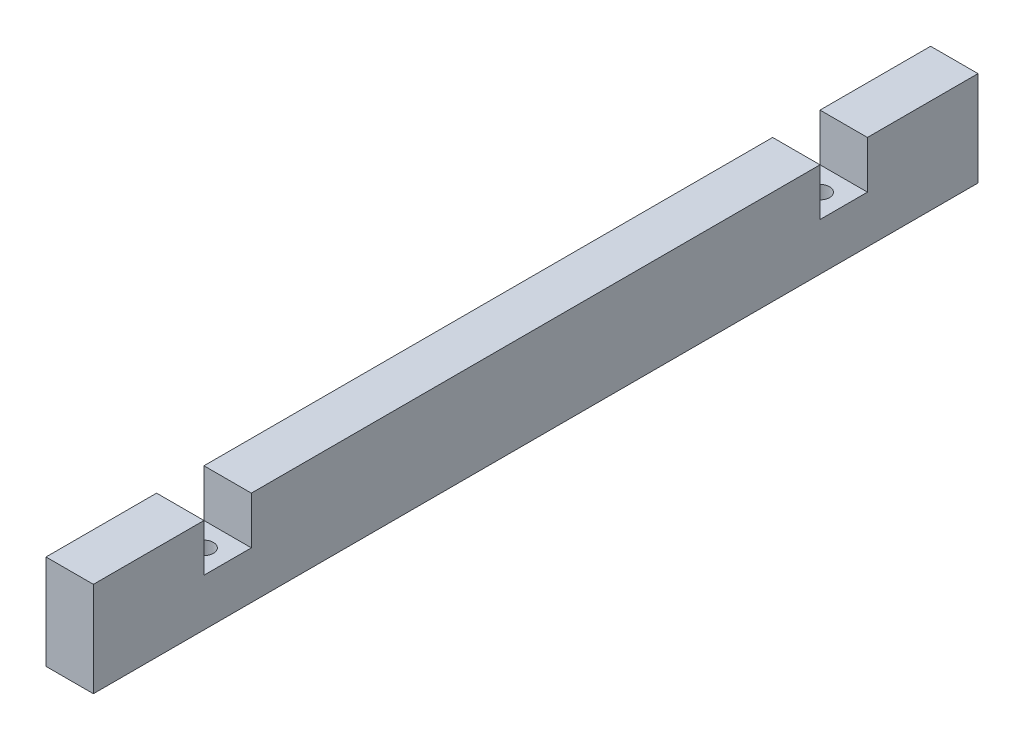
SolidWorks part; units mm, degrees
ref_plane "Plan de face" through (0, 0, 0) normal (0, 0, 1) x (1, 0, 0)
ref_plane "Plan de dessus" through (0, 0, 0) normal (0, 1, 0) x (1, 0, 0)
ref_plane "Plan de droite" through (0, 0, 0) normal (1, 0, 0) x (0, 0, -1)
sketch "Esquisse1" plane through (0, 0, 0) normal (0, 0, 1) x (1, 0, 0)
  line L1 (0, 0) -> (-15, 0)
  line L2 (0, 0) -> (0, 30)
  line L3 (0, 30) -> (-15, 30)
  line L4 (-15, 0) -> (-15, 30)
  dimension "D1" = 15
  dimension "D2" = 30
extrude "Boss.-Extru.1" add sketch "Esquisse1" along normal mid plane 280
sketch "Esquisse2" plane through (0, 0, 0) normal (1, 0, 0) x (0, 0, -1)
  line L0 (-140, 30) -> (140, 30) construction
  line L1 (105, 30) -> (90, 30)
  line L2 (105, 30) -> (105, 15)
  line L3 (105, 15) -> (90, 15)
  line L4 (90, 30) -> (90, 15)
  dimension "D1" = 15
  dimension "D2" = 15
  dimension "D3" = 90
extrude "Enlèv. mat.-Extru.1" cut sketch "Esquisse2" against normal through all
sketch "Esquisse3" plane through (0, 15, 0) normal (0, 1, 0) x (1, 0, 0)
  line L0 (-15, 105) -> (0, 105) construction
  line L1 (0, 90) -> (0, 105) construction
  circle A0 centre (-7.5, 97.5) radius 3
  dimension "D3" = 6
  dimension "D1" = 7.5
  dimension "D2" = 7.5
extrude "Enlèv. mat.-Extru.2" cut sketch "Esquisse3" against normal through all
mirror "Symétrie1" about plane through (0, 0, 0) normal (0, 0, 1) of "Enlèv. mat.-Extru.2", "Enlèv. mat.-Extru.1"
